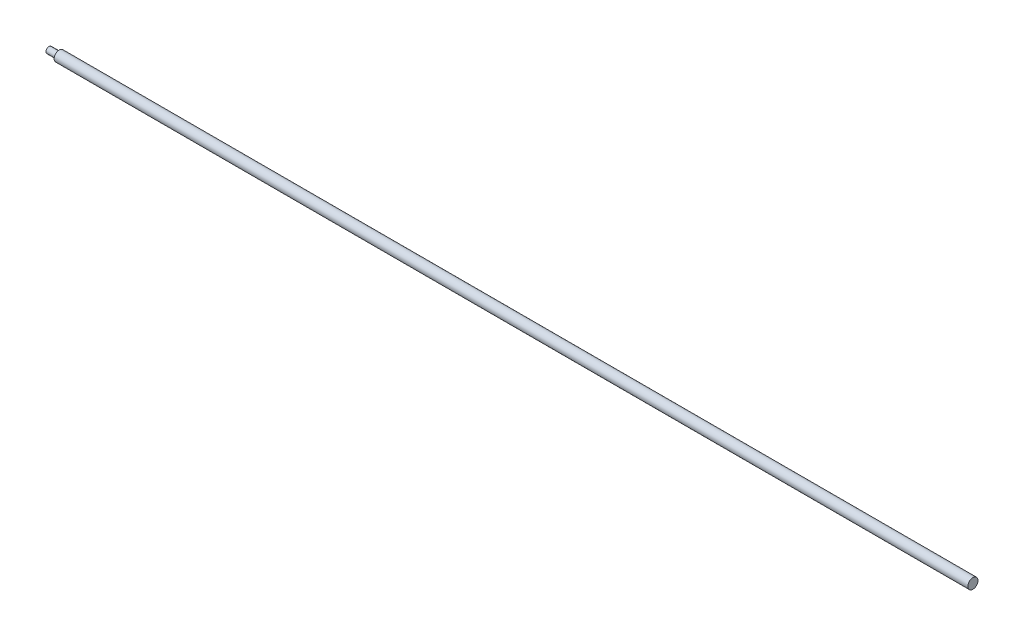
SolidWorks part; units mm, degrees
ref_plane "Plan de face" through (0, 0, 0) normal (0, 0, 1) x (1, 0, 0)
ref_plane "Plan de dessus" through (0, 0, 0) normal (0, 1, 0) x (1, 0, 0)
ref_plane "Plan de droite" through (0, 0, 0) normal (1, 0, 0) x (0, 0, -1)
sketch "Esquisse1" plane through (0, 0, 0) normal (1, 0, 0) x (0, 0, -1)
  circle A0 centre (0, 0) radius 5
  dimension "D1" = 10
extrude "Extrusion1" add sketch "Esquisse1" along normal blind 910
sketch "Esquisse2" plane through (0, 0, 0) normal (-1, 0, 0) x (0, 0, 1)
  circle A0 centre (0, 0) radius 3
  dimension "D1" = 6
extrude "Enlèv. mat.-Extru.1" cut sketch "Esquisse2" against normal blind 10 flip side to cut
